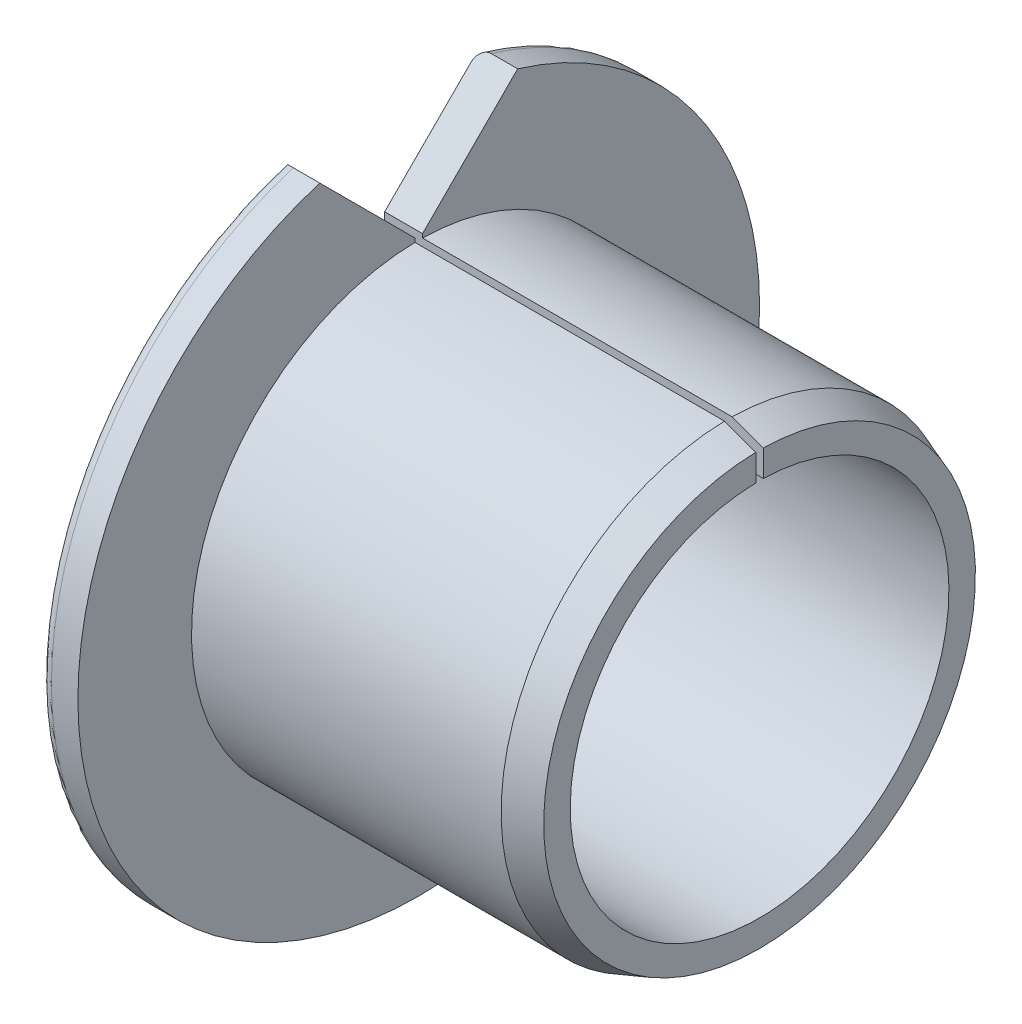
SolidWorks part; units mm, degrees
ref_plane "Plane1" through (0, 0, 0) normal (0, 0, 1) x (1, 0, 0)
ref_plane "Plane2" through (0, 0, 0) normal (0, 1, 0) x (1, 0, 0)
ref_plane "Plane3" through (0, 0, 0) normal (1, 0, 0) x (0, 0, -1)
sketch "Esquisse1" plane through (0, 0, 0) normal (0, 0, 1) x (1, 0, 0)
  line L0 (0, 5) -> (0, 9)
  line L1 (0, 9) -> (1, 9)
  line L2 (1, 9) -> (1, 6)
  line L3 (1, 6) -> (10, 6)
  line L4 (10, 6) -> (10, 5)
  line L5 (10, 5) -> (0, 5)
  line L6 (7, 0) -> (15, 0) construction
revolve "Base-Révolution" add sketch "Esquisse1" angle 360 about L6
sketch "Esquisse3" plane through (1, 0, 0) normal (1, 0, 0) x (0, 0, -1)
  line L0 (0, 6) -> (3.5, 9.5)
  line L1 (3.5, 9.5) -> (-3.5, 9.5)
  line L2 (-3.5, 9.5) -> (0, 6)
  circle A0 centre (0, 0) radius 6 construction
extrude "Enlèv. mat.-Extru.1" cut sketch "Esquisse3" against normal blind 10
sketch "Esquisse4" plane through (10, 0, 0) normal (1, 0, 0) x (0, 0, -1)
  line L0 (-0.1, 6.2) -> (0.1, 6.2)
  line L1 (-0.1, 6.2) -> (-0.1, 4.9)
  line L2 (0.1, 4.9) -> (-0.1, 4.9)
  line L3 (0.1, 4.9) -> (0.1, 6.2)
extrude "Enlèv. mat.-Extru.2" cut sketch "Esquisse4" against normal through all
chamfer "Chanfrein1" distance 0.3 angle 70
fillet "Congé1" radius 0.3
